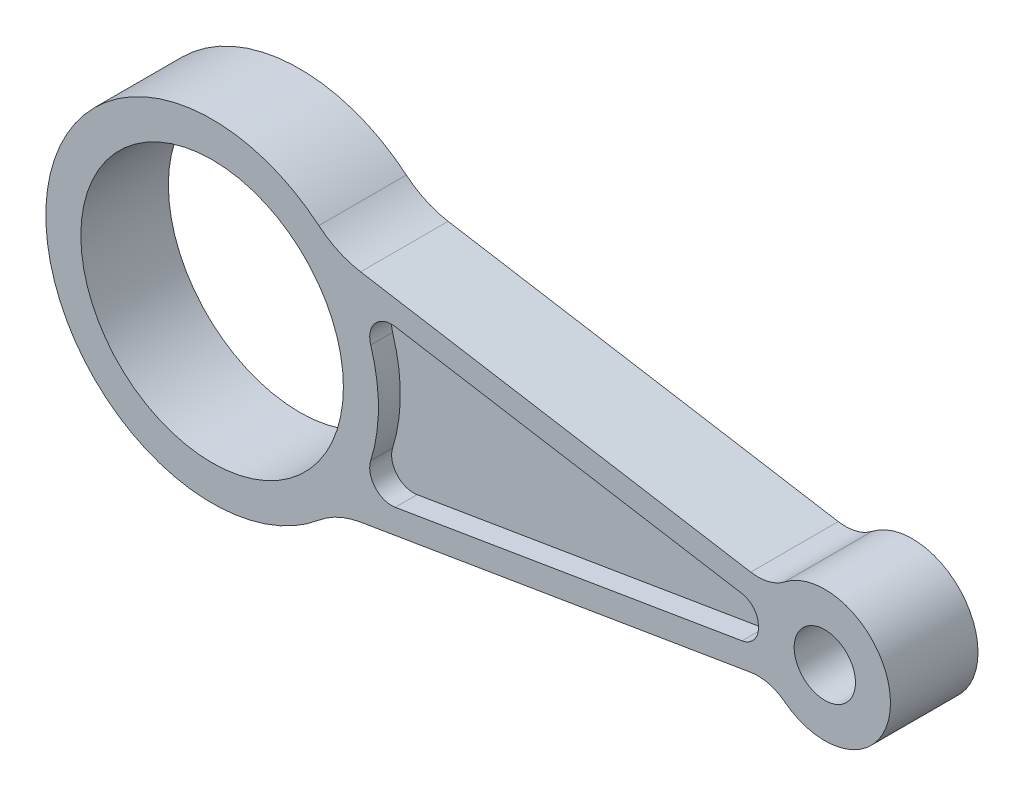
SolidWorks part; units mm, degrees
ref_plane "Front" through (0, 0, 0) normal (0, 0, 1) x (1, 0, 0)
ref_plane "Top" through (0, 0, 0) normal (0, 1, 0) x (1, 0, 0)
ref_plane "Right" through (0, 0, 0) normal (1, 0, 0) x (0, 0, -1)
sketch "Sketch1"
  dimension "D1" = 76
  dimension "D3" = 60
  dimension "D4" = 14
  dimension "D5" = 30
  dimension "D2" = 140
extrude "Base-Extrude" add sketch "Sketch1" against normal blind 20
fillet "Fillet1" radius 10 2 edges at (128.0638, 9.0844, -10) (128.0638, -9.0844, -10)
fillet "Fillet2" radius 20 2 edges at (27.9355, 25.7606, -10) (27.9355, -25.7606, -10)
sketch "Sketch2"
  dimension "D1" = 76
  dimension "D2" = 30
  dimension "D5" = 5
  dimension "D6" = 5
  dimension "D7" = 4.5
  dimension "D8" = 4.5
  dimension "D3" = 5.5
  dimension "D4" = 5.5
extrude "Cut-Extrude1" cut sketch "Sketch2" against normal blind 5
sketch "Sketch3"
  dimension "D1" = 76
  dimension "D2" = 5
  dimension "D5" = 4.5
  dimension "D6" = 4.5
  dimension "D7" = 5
  dimension "D3" = 5.5
  dimension "D4" = 5.5
extrude "Cut-Extrude2" cut sketch "Sketch3" against normal blind 5
sketch "Sketch4"
  dimension "D1" = 14
